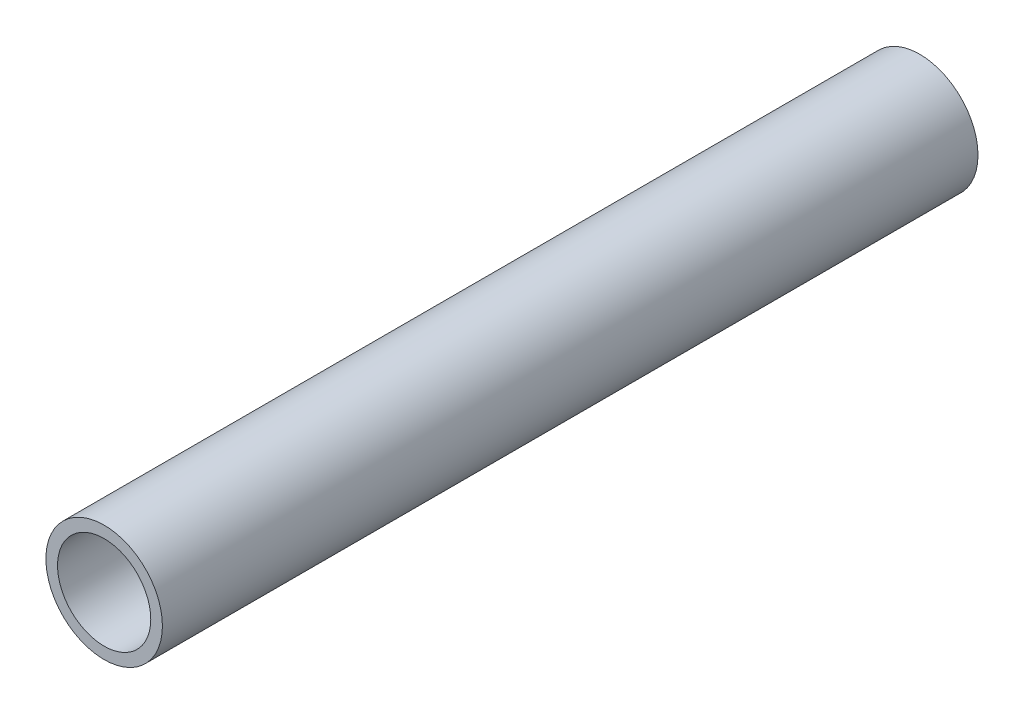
SolidWorks part; units mm, degrees
ref_plane "Plane1" through (0, 0, 0) normal (0, 0, 1) x (1, 0, 0)
ref_plane "Plane2" through (0, 0, 0) normal (0, 1, 0) x (1, 0, 0)
ref_plane "Plane3" through (0, 0, 0) normal (1, 0, 0) x (0, 0, -1)
sketch "Sketch1" plane through (0, 0, 0) normal (0, 0, 1) x (1, 0, 0)
  circle A0 centre (0, 0) radius 3.175
  circle A1 centre (0, 0) radius 2.54
  dimension "D1" = 5.08
  dimension "D2" = 6.35
extrude "Extrude1" add sketch "Sketch1" along normal mid plane 44.45
